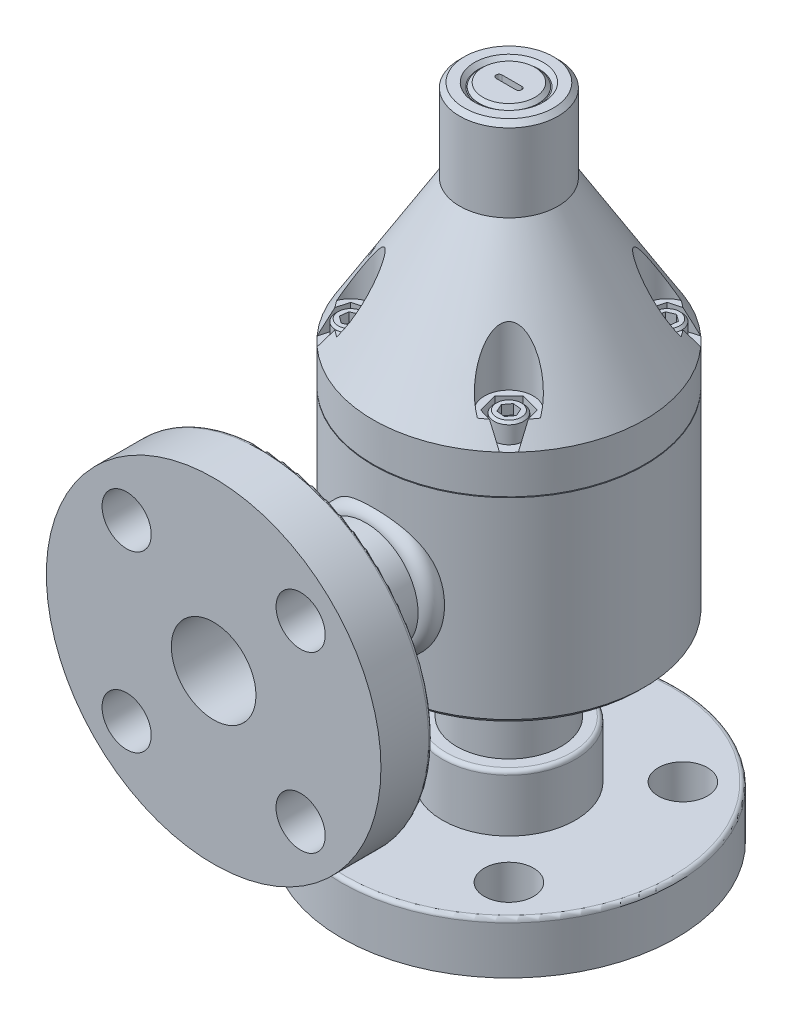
SolidWorks part; units mm, degrees
ref_plane "Front Plane" through (0, 0, 0) normal (0, 0, 1) x (1, 0, 0)
ref_plane "Top Plane" through (0, 0, 0) normal (0, 1, 0) x (1, 0, 0)
ref_plane "Right Plane" through (0, 0, 0) normal (1, 0, 0) x (0, 0, -1)
sketch "Sketch1" plane through (0, 0, 0) normal (0, 1, 0) x (1, 0, 0)
  circle A0 centre (0, 0) radius 43.815
  dimension "D1" = 87.63
extrude "Extrude1" add sketch "Sketch1" along normal blind 148.59
sketch "Sketch2" plane through (0, 0, 0) normal (0, 0, 1) x (1, 0, 0)
  line L0 (0, 148.59) -> (0, 0) construction
  line L1 (43.815, 148.59) -> (-43.815, 148.59) construction
  line L2 (-52.6288, 63.5) -> (-30.226, 63.5)
  line L4 (-30.226, 63.5) -> (-30.226, 63.754)
  line L5 (-30.226, 63.754) -> (-43.815, 63.754)
  line L7 (-43.815, 63.754) -> (-43.815, 76.2)
  line L8 (-43.815, 76.2) -> (-15.875, 121.92)
  line L9 (-15.875, 121.92) -> (-15.875, 152.4)
  line L10 (-15.875, 152.4) -> (-52.6288, 152.4)
  line L11 (-52.6288, 152.4) -> (-52.6288, 63.5)
  line L12 (-43.815, 0) -> (43.815, 0) construction
  dimension "D1" = 43.815
  dimension "D2" = 15.875
  dimension "D3" = 63.5
  dimension "D4" = 30.226
  dimension "D5" = 0.254
  dimension "D6" = 76.2
  dimension "D7" = 152.4
  dimension "D8" = 121.92
revolve "Cut-Revolve1" cut sketch "Sketch2" angle 360 about L0
chamfer "Chamfer1" distance 1.524 angle 45 2 edges at (0, 0, 43.815) (0, 148.59, 15.875)
ref_plane "Plane1" through (0, 148.59, 0) normal (0, 1, 0) x (-1, 0, 0)
sketch "Sketch3" plane through (0, 148.59, 0) normal (0, 1, 0) x (-1, 0, 0)
  circle A0 centre (0, 0) radius 11.1125
  dimension "D1" = 22.225
extrude "Extrude2" cut sketch "Sketch3" against normal blind 1.27 draft 45
sketch "Sketch4" plane through (0, 148.59, 0) normal (0, 1, 0) x (-1, 0, 0)
  circle A0 centre (0, 0) radius 9.525
  dimension "D1" = 19.05
extrude "Extrude3" add sketch "Sketch4" against normal up to surface (1.27 mm away)
chamfer "Chamfer2" distance 1.143 angle 45 1 edges at (0, 148.59, 9.525)
sketch "Sketch5" plane through (0, 148.59, 0) normal (0, 1, 0) x (-1, 0, 0)
  line L0 (3.175, 0) -> (-3.175, 0) construction
  line L1 (3.175, 0.9652) -> (-3.175, 0.9652)
  line L2 (-3.175, -0.9652) -> (3.175, -0.9652)
  arc A0 (-3.175, 0.9652) -> (-3.175, -0.9652) centre (-3.175, 0) ccw
  arc A1 (3.175, -0.9652) -> (3.175, 0.9652) centre (3.175, 0) ccw
  dimension "D1" = 3.175
  dimension "D2" = 6.35
  dimension "D3" = 0.9652
  dimension "D4" = 0.9652
extrude "Extrude4" cut sketch "Sketch5" against normal blind 3.175 draft 1
ref_plane "Plane2" through (0, 82.55, 0) normal (0, 1, 0) x (-1, 0, 0)
sketch "Sketch6" plane through (0, 82.55, 0) normal (0, 1, 0) x (-1, 0, 0)
  line L0 (0, 0) -> (-30.9819, 30.9819) construction
  circle A0 centre (0, 0) radius 36.0934 construction
  circle A1 centre (0, 0) radius 43.815 construction
  circle A2 centre (-25.5219, 25.5219) radius 7.874
  dimension "D1" = 15.748
extrude "Extrude5" cut sketch "Sketch6" along normal blind 22.86
sketch "Sketch7" plane through (0, 82.55, 0) normal (0, 1, 0) x (-1, 0, 0)
  line L0 (0, 0) -> (-25.5219, 25.5219) construction
  line L1 (-25.5219, 25.5219) -> (-31.0896, 19.9541) construction
  line L2 (-25.5219, 25.5219) -> (-19.9541, 31.0896) construction
  line L3 (-25.5219, 25.5219) -> (-39.3911, 39.3911) construction
  line L4 (-30.0845, 20.9593) -> (-23.8519, 19.2893)
  line L5 (-23.8519, 19.2893) -> (-19.2893, 23.8519)
  line L6 (-19.2893, 23.8519) -> (-20.9593, 30.0845)
  line L10 (-30.0845, 20.9593) -> (-33.6536, 33.6536)
  line L11 (-33.6536, 33.6536) -> (-20.9593, 30.0845)
  line L13 (-27.1919, 31.7545) -> (-31.7545, 27.1919)
  line L14 (-20.9593, 30.0845) -> (-27.1919, 31.7545)
  line L15 (-31.7545, 27.1919) -> (-30.0845, 20.9593)
  arc A0 (-32.8666, 22.6837) -> (-22.6837, 32.8666) centre (-25.5219, 25.5219) ccw construction
  circle A1 centre (-25.5219, 25.5219) radius 5.588 construction
extrude "Extrude6" cut sketch "Sketch7" against normal blind 6.35
sketch "Sketch8" plane through (0, 82.55, 0) normal (0, 1, 0) x (-1, 0, 0)
  circle A0 centre (-25.5219, 25.5219) radius 4.7625
  dimension "D1" = 9.525
extrude "Extrude7" add sketch "Sketch8" against normal up to surface (6.35 mm away)
sketch "Sketch9" plane through (0, 82.55, 0) normal (0, 1, 0) x (-1, 0, 0)
  line L1 (-23.8739, 27.7452) -> (-26.6233, 28.0608)
  line L2 (-26.6233, 28.0608) -> (-28.2713, 25.8375)
  line L3 (-28.2713, 25.8375) -> (-27.1699, 23.2986)
  line L4 (-27.1699, 23.2986) -> (-24.4205, 22.983)
  line L5 (-24.4205, 22.983) -> (-22.7725, 25.2063)
  line L6 (-22.7725, 25.2063) -> (-23.8739, 27.7452)
  circle A0 centre (-25.5219, 25.5219) radius 2.3967 construction
extrude "Extrude8" cut sketch "Sketch9" against normal blind 3.175
pattern_circular "CirPattern1" count 4 over 360 about axis through (0, 0, 0) along (0, 1, 0) of "Extrude5", "Extrude6", "Extrude7", "Extrude8"
chamfer "Chamfer3" distance 0.762 angle 45 4 edges at (25.5219, 82.55, 30.2844) (30.2844, 82.55, -25.5219) (-25.5219, 82.55, -30.2844) (-30.2844, 82.55, 25.5219)
ref_plane "Plane3" through (0, 0, 95.25) normal (0, 0, 1) x (1, 0, 0)
sketch "Sketch10" plane through (0, 0, 95.25) normal (0, 0, 1) x (1, 0, 0)
  line L0 (0, 0) -> (0, 148.59) construction
  line L2 (-3.175, 148.59) -> (3.175, 148.59) construction
  line L3 (43.815, 31.75) -> (-43.815, 31.75) construction
  line L4 (43.815, 1.524) -> (43.815, 63.5) construction
  line L5 (-43.815, 63.5) -> (-43.815, 1.524) construction
  line L6 (-42.291, 0) -> (42.291, 0) construction
  circle A0 centre (0, 31.75) radius 53.975
  dimension "D2" = 107.95
  dimension "D1" = 31.75
extrude "Boss-Extrude1" add sketch "Sketch10" against normal blind 16.6624 separate body
sketch "Sketch11" plane through (0, 0, 95.25) normal (0, 0, 1) x (1, 0, 0)
  circle A0 centre (0, 31.75) radius 21.4249
  dimension "D1" = 42.8498
extrude "Boss-Extrude2" add sketch "Sketch11" against normal blind 34.925
sketch "Sketch12" plane through (0, 0, 95.25) normal (0, 0, 1) x (1, 0, 0)
  circle A0 centre (0, 31.75) radius 16.8275
  dimension "D1" = 33.655
extrude "Boss-Extrude3" add sketch "Sketch12" against normal up to surface (54.7952 mm away)
sketch "Sketch13" plane through (0, 0, 95.25) normal (0, 0, 1) x (1, 0, 0)
  line L0 (0, 31.75) -> (-53.975, 31.75) construction
  line L1 (0, 31.75) -> (-38.1661, 69.9161) construction
  circle A0 centre (0, 31.75) radius 53.975 construction
  circle A1 centre (0, 31.75) radius 39.6875 construction
  circle A2 centre (-28.0633, 59.8133) radius 7.9375
  dimension "D2" = 79.375
  dimension "D3" = 15.875
  dimension "D1" = 45
extrude "Cut-Extrude1" cut sketch "Sketch13" against normal blind 34.925
pattern_circular "CirPattern3" count 4 over 360 about axis through (0, 31.75, 0) along (0, 0, 1) of "Cut-Extrude1"
sketch "Sketch14" plane through (0, 0, 95.25) normal (0, 0, 1) x (1, 0, 0)
  circle A0 centre (0, 31.75) radius 13.6525
  dimension "D1" = 27.305
extrude "Cut-Extrude2" cut sketch "Sketch14" against normal blind 25.4
sketch "Sketch19" plane through (0, 0, 0) normal (1, 0, 0) x (0, 0, -1)
  line L0 (-46.147, 46.3279) -> (-46.147, 48.2109)
  line L2 (-38.7005, 48.5533) -> (-38.7005, 44.2737)
  line L3 (-38.7005, 44.2737) -> (-46.147, 46.3279)
  line L4 (-59.3637, 31.8439) -> (0, 31.8439) construction
  arc A0 (-46.147, 48.2109) -> (-38.7005, 48.5533) centre (-42.4159, 48.2109) cw
revolve "Revolve1" add sketch "Sketch19" angle 360 about L4
ref_plane "Plane5" through (0, -63.5, 0) normal (0, 1, 0) x (1, 0, 0)
sketch "Sketch20" plane through (0, -63.5, 0) normal (0, 1, 0) x (1, 0, 0)
  circle A0 centre (0, 0) radius 53.975
  dimension "D1" = 107.95
extrude "Boss-Extrude7" add sketch "Sketch20" along normal blind 16.6624 separate body
sketch "Sketch21" plane through (0, -63.5, 0) normal (0, 1, 0) x (1, 0, 0)
  circle A0 centre (0, 0) radius 21.463
  dimension "D1" = 42.926
extrude "Boss-Extrude8" add sketch "Sketch21" along normal blind 34.925
sketch "Sketch22" plane through (0, -63.5, 0) normal (0, 1, 0) x (1, 0, 0)
  circle A0 centre (0, 0) radius 16.8275
  dimension "D1" = 33.655
extrude "Boss-Extrude9" add sketch "Sketch22" along normal up to surface (63.5 mm away)
fillet "Fillet2" radius 1.27 2 edges at (0, -46.8376, 53.975) (0, -28.575, 21.463)
sketch "Sketch23" plane through (0, -63.5, 0) normal (0, 1, 0) x (1, 0, 0)
  circle A0 centre (0, 0) radius 13.6525
  dimension "D1" = 27.305
extrude "Cut-Extrude4" cut sketch "Sketch23" along normal blind 25.4
sketch "Sketch24" plane through (0, -63.5, 0) normal (0, 1, 0) x (1, 0, 0)
  line L0 (0, 0) -> (-53.975, 0) construction
  line L1 (0, 0) -> (-38.1661, -38.1661) construction
  circle A0 centre (0, 0) radius 53.975 construction
  circle A4 centre (0, 0) radius 39.6875 construction
  circle A5 centre (-28.0633, -28.0633) radius 7.9375
  dimension "D2" = 79.375
  dimension "D3" = 15.875
  dimension "D1" = 45
extrude "Cut-Extrude5" cut sketch "Sketch24" along normal blind 25.4
pattern_circular "CirPattern5" count 4 over 360 about axis through (0, 0, 0) along (0, 1, 0) of "Cut-Extrude5"
fillet "Fillet3" radius 1.27 2 edges at (53.975, 31.75, 78.5876) (21.4249, 31.75, 60.325)
sketch "Sketch25" plane through (0, 0, 0) normal (1, 0, 0) x (0, 0, -1)
  line L0 (-20.0025, 0.352) -> (-20.0025, 2.6064)
  line L1 (-20.0025, 2.6064) -> (-16.0841, 2.6064)
  line L2 (-16.0841, 2.6064) -> (-16.0841, -3.175)
  line L3 (-16.8275, 0) -> (-16.8275, -28.575) construction
  line L4 (-42.291, 0) -> (42.291, 0) construction
  line L5 (0, 0) -> (0, -10.6519) construction
  arc A0 (-16.0841, -3.175) -> (-20.0025, 0.352) centre (-17.1456, -0.4141) cw
  dimension "D1" = 3.175
  dimension "D2" = 3.175
revolve "Revolve2" add sketch "Sketch25" angle 360 about L5
